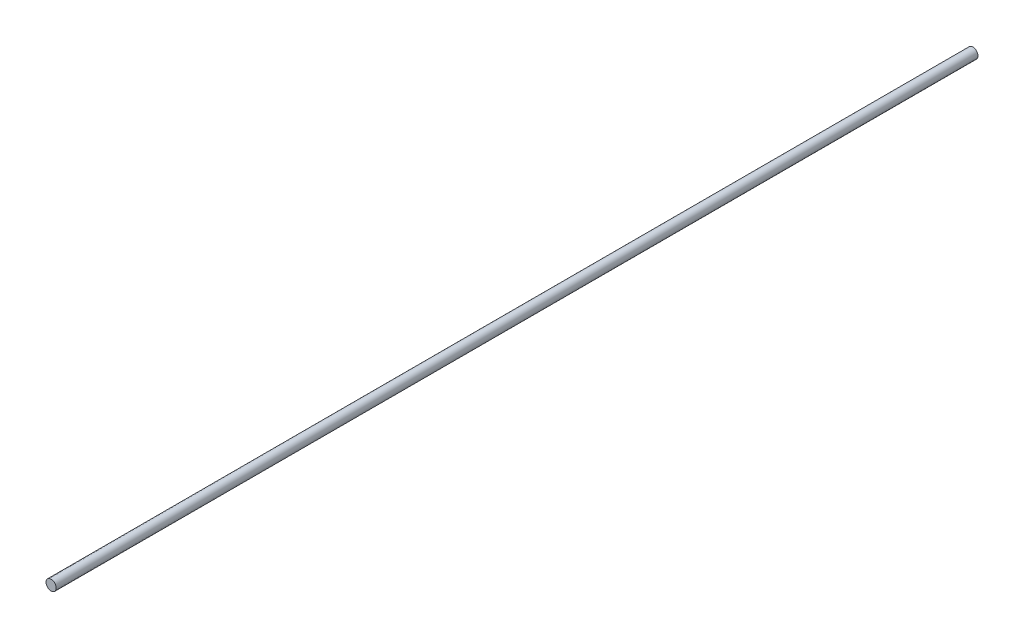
SolidWorks part; units mm, degrees
ref_plane "Front Plane" through (0, 0, 0) normal (0, 0, 1) x (1, 0, 0)
ref_plane "Top Plane" through (0, 0, 0) normal (0, 1, 0) x (1, 0, 0)
ref_plane "Right Plane" through (0, 0, 0) normal (1, 0, 0) x (0, 0, -1)
sketch "Sketch1" plane through (0, 0, 0) normal (0, 0, 1) x (1, 0, 0)
  circle A0 centre (0, 0) radius 30
  dimension "D1" = 60
extrude "Boss-Extrude1" add sketch "Sketch1" against normal blind 5400
